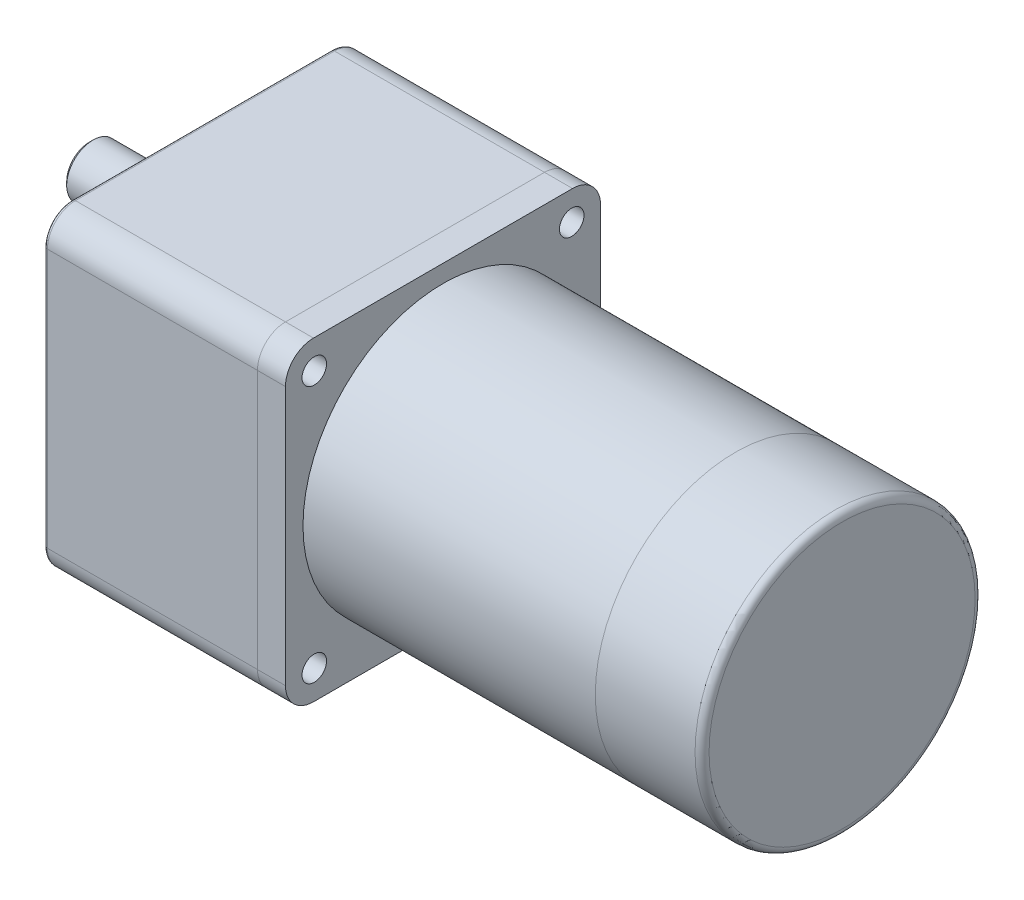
SolidWorks part; units mm, degrees
ref_plane "前视基准面" through (0, 0, 0) normal (0, 0, 1) x (1, 0, 0)
ref_plane "上视基准面" through (0, 0, 0) normal (0, 1, 0) x (1, 0, 0)
ref_plane "右视基准面" through (0, 0, 0) normal (1, 0, 0) x (0, 0, -1)
sketch "草图1" plane through (0, 0, 0) normal (1, 0, 0) x (0, 0, -1)
  line L1 (-37, -45) -> (37, -45)
  line L2 (-45, -37) -> (-45, 37)
  line L3 (-37, 45) -> (37, 45)
  line L4 (45, -37) -> (45, 37)
  line L5 (-45, -45) -> (45, 45) construction
  line L6 (-45, 45) -> (45, -45) construction
  arc A0 (-37, -45) -> (-45, -37) centre (-37, -37) cw
  arc A1 (37, -45) -> (45, -37) centre (37, -37) ccw
  arc A2 (37, 45) -> (45, 37) centre (37, 37) cw
  arc A3 (-45, 37) -> (-37, 45) centre (-37, 37) cw
  point P0 (0, 0)
  dimension "D1" = 8
extrude "凸台-拉伸1" add sketch "草图1" along normal blind 61
sketch "草图2" plane through (61, 0, 0) normal (1, 0, 0) x (0, 0, -1)
  line L0 (37, 45) -> (-37, 45) construction
  line L1 (-37, -45) -> (37, -45)
  line L2 (-45, -37) -> (-45, 37)
  line L3 (-37, 45) -> (37, 45)
  line L4 (45, -37) -> (45, 37)
  line L5 (-45, -45) -> (45, 45) construction
  line L6 (-45, 45) -> (45, -45) construction
  arc A0 (37, 45) -> (45, 37) centre (37, 37) cw
  arc A1 (37, -45) -> (45, -37) centre (37, -37) ccw
  arc A2 (-37, -45) -> (-45, -37) centre (-37, -37) cw
  arc A3 (-45, 37) -> (-37, 45) centre (-37, 37) cw
  point P0 (0, 0)
  dimension "D1" = 8
extrude "凸台-拉伸2" add sketch "草图2" along normal blind 8 separate body
fillet "圆角1" radius 1 8 edges at (0, -45, 0) (0, -42.6569, -42.6569) (0, 0, -45) (0, 42.6569, -42.6569) (0, 45, 0) (0, 42.6569, 42.6569) (0, 0, 45) (0, -42.6569, 42.6569)
sketch "草图3" plane through (69, 0, 0) normal (1, 0, 0) x (0, 0, -1)
  circle A0 centre (0, 0) radius 40
extrude "凸台-拉伸3" add sketch "草图3" along normal blind 83.5 separate body
sketch "草图4" plane through (152.5, 0, 0) normal (1, 0, 0) x (0, 0, -1)
  circle A0 centre (0, 0) radius 40
extrude "凸台-拉伸4" add sketch "草图4" along normal blind 30.5 separate body
fillet "圆角2" radius 2 1 edges at (183, 0, -40)
sketch "草图6" plane through (0, 0, 0) normal (-1, 0, 0) x (0, 0, 1)
  circle A0 centre (0, 18) radius 16
extrude "凸台-拉伸5" add sketch "草图6" along normal blind 3 separate body
fillet "圆角3" radius 0.5 1 edges at (-3, 18, 16)
sketch "草图7" plane through (-3, 0, 0) normal (-1, 0, 0) x (0, 0, 1)
  circle A0 centre (0, 18) radius 7.5
extrude "凸台-拉伸6" add sketch "草图7" along normal blind 29 separate body
ref_plane "基准面1" through (0, 0, -7.5) normal (0, 0, 1) x (1, 0, 0)
sketch "草图8" plane through (0, 0, -7.5) normal (0, 0, 1) x (1, 0, 0)
  line L1 (-32, 25.5) -> (-32, 10.5) construction
  line L2 (-9.5, 20.5) -> (-32, 20.5)
  line L3 (-32, 20.5) -> (-32, 15.5)
  line L4 (-32, 15.5) -> (-9.5, 15.5)
  arc A0 (-9.5, 15.5) -> (-9.5, 20.5) centre (-9.5, 18) ccw
extrude "切除-拉伸2" cut sketch "草图8" along normal blind 3
chamfer "倒角2" distance 1 angle 45 1 edges at (-32, 18, 7.5)
sketch "草图9" plane through (0, 0, 0) normal (-1, 0, 0) x (0, 0, 1)
  circle A0 centre (0, 0) radius 41.4
extrude "切除-拉伸3" cut sketch "草图9" against normal blind 0.5
fillet "圆角4" radius 0.5 1 edges at (0, 0, 41.4)
sketch "草图10" plane through (0, 0, 0) normal (-1, 0, 0) x (0, 0, 1)
  point P19 (-36.7696, 36.7696)
  point P20 (36.7696, 36.7696)
  point P21 (36.7696, -36.7696)
  point P22 (-36.7696, -36.7696)
hole_wizard "M6 螺纹孔1" positions "3D草图1" profile "草图11" tap size "M6" standard "GB"
sketch3d "3D草图1"
  point P0 (0, 36.7696, -36.7696)
  point P3 (0, 36.7696, 36.7696)
  point P6 (0, -36.7696, 36.7696)
  point P9 (0, -36.7696, -36.7696)
sketch "草图11" plane through (0, 36.7696, -36.7696) normal (0, 1, 0) x (0, 0, 1)
  line L0 (0, 0) -> (0, 18.5022)
  line L1 (0, 18.5022) -> (2.5, 17)
  line L2 (2.5, 17) -> (2.5, 0)
  line L5 (2.5, 0) -> (0, 0)
  line L10 (0, 18.5022) -> (-2.5, 17) construction
  line L11 (0, -6.35) -> (0, 107.95) construction
  dimension "螺纹孔钻头直径" = 5
  dimension "螺纹孔钻头深度" = 17
  dimension "导头角度" = 118
sketch "草图13" plane through (69, 0, 0) normal (1, 0, 0) x (0, 0, -1)
  circle A0 centre (-36.7696, 36.7696) radius 3.5
  circle A1 centre (36.7696, 36.7696) radius 3.5
  circle A2 centre (36.7696, -36.7696) radius 3.5
  circle A3 centre (-36.7696, -36.7696) radius 3.5
extrude "切除-拉伸4" cut sketch "草图13" against normal blind 62
fillet "圆角5" radius 1 4 edges at (0, -36.7696, -34.2696) (0, -36.7696, 39.2696) (0, 36.7696, 39.2696) (0, 36.7696, -34.2696)
